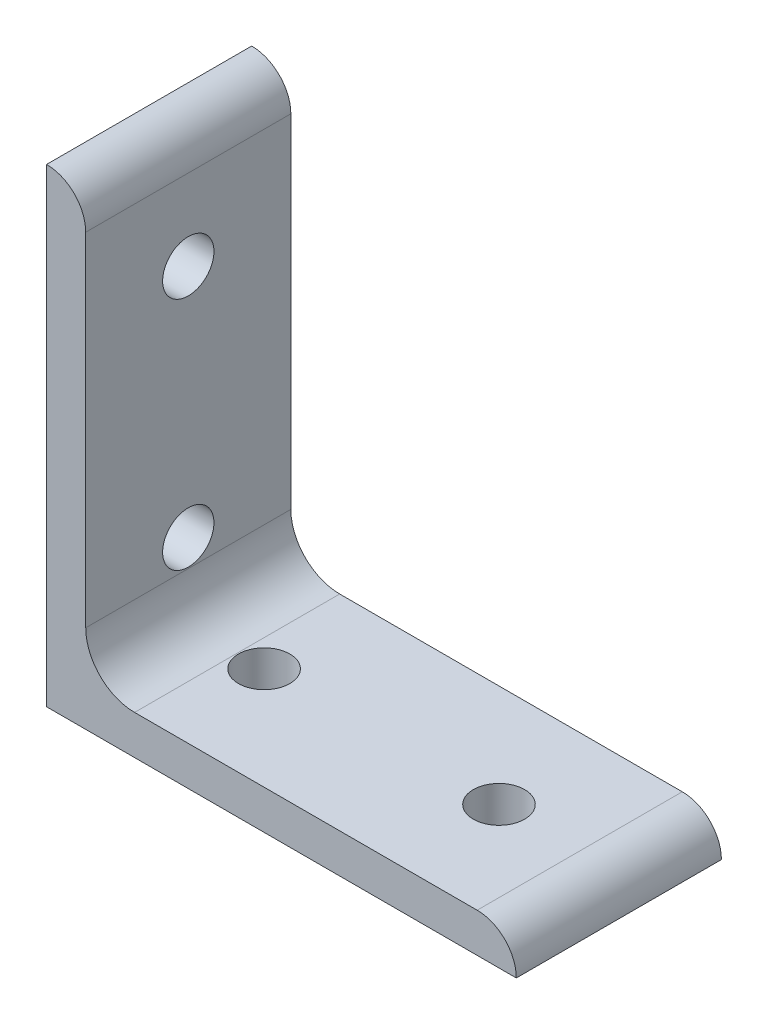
SolidWorks part; units mm, degrees
ref_plane "Front Plane" through (0, 0, 0) normal (0, 0, 1) x (1, 0, 0)
ref_plane "Top Plane" through (0, 0, 0) normal (0, 1, 0) x (1, 0, 0)
ref_plane "Right Plane" through (0, 0, 0) normal (1, 0, 0) x (0, 0, -1)
sketch "Sketch1" plane through (0, 0, 0) normal (0, 0, 1) x (1, 0, 0)
  line L0 (0, 0) -> (0, 76.2)
  line L1 (6.35, 69.85) -> (6.35, 76.2) construction
  line L2 (6.35, 69.85) -> (6.35, 14.2748)
  line L3 (14.2748, 6.35) -> (69.85, 6.35)
  line L4 (6.35, 76.2) -> (0, 76.2) construction
  line L5 (76.2, 0) -> (0, 0)
  line L6 (69.85, 6.35) -> (76.2, 6.35) construction
  line L7 (76.2, 6.35) -> (76.2, 0) construction
  arc A0 (6.35, 69.85) -> (0, 76.2) centre (0, 69.85) ccw
  arc A1 (76.2, 0) -> (69.85, 6.35) centre (69.85, 0) ccw
  arc A2 (6.35, 14.2748) -> (14.2748, 6.35) centre (14.2748, 14.2748) ccw
  point P10 (6.35, 73.025)
  dimension "E" = 7.9248
  dimension "D" = 6.35
  dimension "C" = 76.2
  dimension "B" = 76.2
extrude "Boss-Extrude1" add sketch "Sketch1" along normal mid plane 33.274
sketch "Sketch2" plane through (0, 0, 0) normal (0, 1, 0) x (1, 0, 0)
  line L0 (0, 0) -> (18.6531, 0) construction
  line L1 (18.6531, 0) -> (56.7531, 0) construction
  circle A0 centre (18.6531, 0) radius 4.1656
  circle A1 centre (56.7531, 0) radius 4.1656
extrude "Cut-Extrude1" cut sketch "Sketch2" along normal through all
sketch "Sketch3" plane through (0, 0, 0) normal (1, 0, 0) x (0, 0, -1)
  line L0 (0, 0) -> (0, 18.6531) construction
  line L1 (0, 18.6531) -> (0, 56.7531) construction
  circle A0 centre (0, 18.6531) radius 4.1656
  circle A1 centre (0, 56.7531) radius 4.1656
extrude "Cut-Extrude2" cut sketch "Sketch3" along normal through all
equation "\"E@Sketch3\" = \"E@Sketch2\""
equation "\"D1@Sketch3\" = \"D1@Sketch2\""
equation "\"D2@Sketch3\" = \"D2@Sketch2\""
